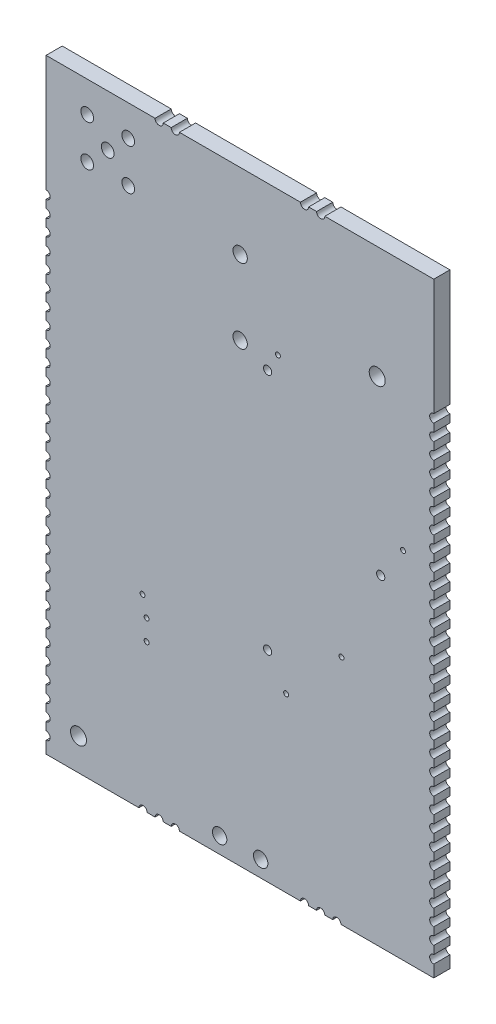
SolidWorks part; units mm, degrees
ref_plane "Front Plane" through (0, 0, 0) normal (0, 0, 1) x (1, 0, 0)
ref_plane "Top Plane" through (0, 0, 0) normal (0, 1, 0) x (1, 0, 0)
ref_plane "Right Plane" through (0, 0, 0) normal (1, 0, 0) x (0, 0, -1)
sketch "Sketch1" plane through (0, 0, 0) normal (0, 0, 1) x (1, 0, 0)
  line L0 (-2.0066, -1.9812) -> (21.9934, -1.9812)
  line L1 (21.9934, -1.9812) -> (21.9934, 35.4838)
  line L2 (21.9934, 35.4838) -> (-2.0066, 35.4838)
  line L3 (-2.0066, 35.4838) -> (-2.0066, -1.9812)
extrude "Board_Outline" add sketch "Sketch1" along normal blind 1 separate body
sketch "Sketch2" plane through (0, 0, 0) normal (0, 0, 1) x (1, 0, 0)
  circle A0 centre (0, 0) radius 0.4953
  circle A1 centre (18.4934, 28.5188) radius 0.4953
  circle A2 centre (11.7094, 10.4578) radius 0.254
  circle A3 centre (11.7094, 25.4578) radius 0.254
  circle A4 centre (18.7094, 17.9578) radius 0.254
extrude "NPTH" cut sketch "Sketch2" along normal through all
sketch "Sketch3" plane through (0, 0, 0) normal (0, 0, 1) x (1, 0, 0)
  circle A0 centre (3.9624, 9.5758) radius 0.1524
  circle A1 centre (12.3444, 26.5938) radius 0.1524
  circle A2 centre (4.2164, 8.4328) radius 0.1524
  circle A3 centre (4.2164, 7.1628) radius 0.1524
  circle A4 centre (16.2814, 12.3698) radius 0.1524
  circle A5 centre (12.8524, 8.6868) radius 0.1524
  circle A6 centre (20.0914, 19.9898) radius 0.1524
  circle A7 centre (-2.0066, 28.0188) radius 0.254
  circle A8 centre (-2.0066, 19.0188) radius 0.254
  circle A9 centre (-2.0066, 18.0188) radius 0.254
  circle A10 centre (-2.0066, 17.0188) radius 0.254
  circle A11 centre (-2.0066, 16.0188) radius 0.254
  circle A12 centre (-2.0066, 15.0188) radius 0.254
  circle A13 centre (-2.0066, 14.0188) radius 0.254
  circle A14 centre (-2.0066, 13.0188) radius 0.254
  circle A15 centre (-2.0066, 12.0188) radius 0.254
  circle A16 centre (-2.0066, 11.0188) radius 0.254
  circle A17 centre (-2.0066, 10.0188) radius 0.254
  circle A18 centre (-2.0066, 27.0188) radius 0.254
  circle A19 centre (-2.0066, 9.0188) radius 0.254
  circle A20 centre (-2.0066, 8.0188) radius 0.254
  circle A21 centre (-2.0066, 7.0188) radius 0.254
  circle A22 centre (-2.0066, 6.0188) radius 0.254
  circle A23 centre (-2.0066, 5.0188) radius 0.254
  circle A24 centre (-2.0066, 4.0188) radius 0.254
  circle A25 centre (-2.0066, 3.0188) radius 0.254
  circle A26 centre (-2.0066, 2.0188) radius 0.254
  circle A27 centre (-2.0066, 1.0188) radius 0.254
  circle A28 centre (-2.0066, 0.0188) radius 0.254
  circle A29 centre (-2.0066, 26.0188) radius 0.254
  circle A30 centre (-2.0066, -0.9812) radius 0.254
  circle A31 centre (3.9934, -1.9812) radius 0.254
  circle A32 centre (4.9934, -1.9812) radius 0.254
  circle A33 centre (5.9934, -1.9812) radius 0.254
  circle A34 centre (13.9934, -1.9812) radius 0.254
  circle A35 centre (14.9934, -1.9812) radius 0.254
  circle A36 centre (15.9934, -1.9812) radius 0.254
  circle A37 centre (21.9934, -0.9812) radius 0.254
  circle A38 centre (21.9934, 0.0188) radius 0.254
  circle A39 centre (21.9934, 1.0188) radius 0.254
  circle A40 centre (-2.0066, 25.0188) radius 0.254
  circle A41 centre (21.9934, 2.0188) radius 0.254
  circle A42 centre (21.9934, 3.0188) radius 0.254
  circle A43 centre (21.9934, 4.0188) radius 0.254
  circle A44 centre (21.9934, 5.0188) radius 0.254
  circle A45 centre (21.9934, 6.0188) radius 0.254
  circle A46 centre (21.9934, 7.0188) radius 0.254
  circle A47 centre (21.9934, 8.0188) radius 0.254
  circle A48 centre (21.9934, 9.0188) radius 0.254
  circle A49 centre (21.9934, 10.0188) radius 0.254
  circle A50 centre (21.9934, 11.0188) radius 0.254
  circle A51 centre (-2.0066, 24.0188) radius 0.254
  circle A52 centre (21.9934, 12.0188) radius 0.254
  circle A53 centre (21.9934, 13.0188) radius 0.254
  circle A54 centre (21.9934, 14.0188) radius 0.254
  circle A55 centre (21.9934, 15.0188) radius 0.254
  circle A56 centre (21.9934, 16.0188) radius 0.254
  circle A57 centre (21.9934, 17.0188) radius 0.254
  circle A58 centre (21.9934, 18.0188) radius 0.254
  circle A59 centre (21.9934, 19.0188) radius 0.254
  circle A60 centre (21.9934, 20.0188) radius 0.254
  circle A61 centre (21.9934, 21.0188) radius 0.254
  circle A62 centre (-2.0066, 23.0188) radius 0.254
  circle A63 centre (21.9934, 22.0188) radius 0.254
  circle A64 centre (21.9934, 23.0188) radius 0.254
  circle A65 centre (21.9934, 24.0188) radius 0.254
  circle A66 centre (21.9934, 25.0188) radius 0.254
  circle A67 centre (21.9934, 26.0188) radius 0.254
  circle A68 centre (21.9934, 27.0188) radius 0.254
  circle A69 centre (21.9934, 28.0188) radius 0.254
  circle A70 centre (-2.0066, 22.0188) radius 0.254
  circle A71 centre (-2.0066, 21.0188) radius 0.254
  circle A72 centre (-2.0066, 20.0188) radius 0.254
  circle A73 centre (13.9934, 35.4838) radius 0.254
  circle A74 centre (4.9934, 35.4838) radius 0.254
  circle A75 centre (14.9934, 35.4838) radius 0.254
  circle A76 centre (5.9934, 35.4838) radius 0.254
  circle A77 centre (10.0076, 26.2188) radius 0.4445
  circle A78 centre (11.2776, -0.9812) radius 0.4445
  circle A79 centre (8.7376, -0.9812) radius 0.4445
  circle A80 centre (10.0076, 30.8188) radius 0.4445
  circle A81 centre (1.809, 32.3088) radius 0.3937
  circle A82 centre (0.539, 31.0388) radius 0.3937
  circle A83 centre (3.079, 31.0388) radius 0.3937
  circle A84 centre (3.079, 33.5788) radius 0.3937
  circle A85 centre (0.539, 33.5788) radius 0.3937
extrude "PTH" cut sketch "Sketch3" along normal through all
sketch "Testpoint_Keepout " plane through (0, 0, 1) normal (0, 0, 1) x (1, 0, 0)
  line L0 (-2.0066, -1.9812) -> (-1.0066, -1.9812)
  line L1 (-1.0066, -1.9812) -> (-1.0066, 32.0188)
  line L2 (-1.0066, 32.0188) -> (-2.0066, 32.0188)
  line L3 (-2.0066, 32.0188) -> (-2.0066, -1.9812)
sketch "Sketch5" plane through (0, 0, 1) normal (0, 0, 1) x (1, 0, 0)
  line L0 (21.9934, -1.9812) -> (20.9934, -1.9812)
  line L1 (20.9934, -1.9812) -> (20.9934, 32.0188)
  line L2 (20.9934, 32.0188) -> (21.9934, 32.0188)
  line L3 (21.9934, 32.0188) -> (21.9934, -1.9812)
sketch "Sketch6" plane through (0, 0, 1) normal (0, 0, 1) x (1, 0, 0)
  line L0 (21.9934, -1.9812) -> (-2.0066, -1.9812)
  line L1 (-2.0066, -1.9812) -> (-2.0066, -0.9812)
  line L2 (-2.0066, -0.9812) -> (21.9934, -0.9812)
  line L3 (21.9934, -0.9812) -> (21.9934, -1.9812)
